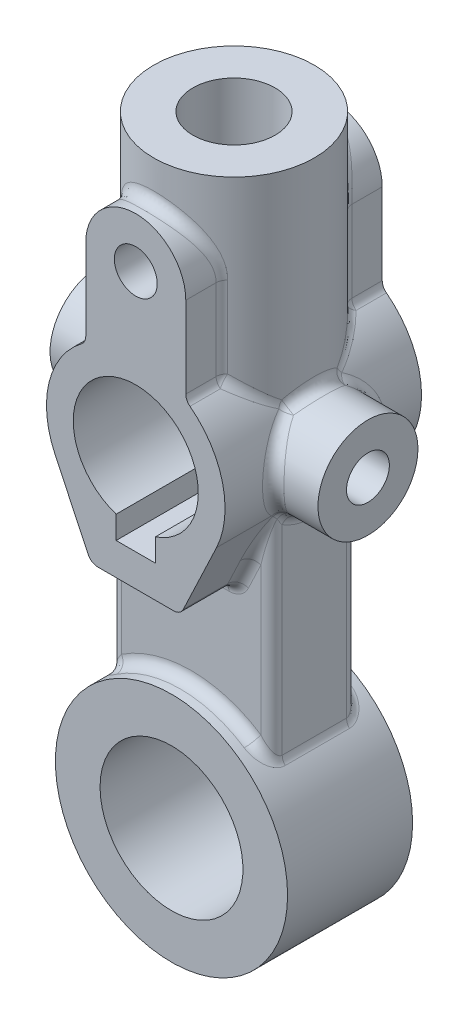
SolidWorks part; units mm, degrees
ref_plane "Front Plane" through (0, 0, 0) normal (0, 0, 1) x (1, 0, 0)
ref_plane "Top Plane" through (0, 0, 0) normal (0, 1, 0) x (1, 0, 0)
ref_plane "Right Plane" through (0, 0, 0) normal (1, 0, 0) x (0, 0, -1)
sketch "Sketch1" plane through (0, 0, 0) normal (0, 0, 1) x (1, 0, 0)
  line L0 (-12.5, -32) -> (-22.5914, -10.7065)
  line L1 (12.5, -32) -> (-12.5, -32)
  line L2 (22.5914, -10.7065) -> (12.5, -32)
  line L3 (0, 0) -> (0, 45) construction
  line L4 (14, 20.7123) -> (14, 45)
  line L5 (-14, 45) -> (-14, 20.7123)
  arc A0 (22.5914, -10.7065) -> (14, 20.7123) centre (0, 0) ccw
  arc A1 (14, 45) -> (-14, 45) centre (0, 45) ccw
  arc A2 (-14, 20.7123) -> (-22.5914, -10.7065) centre (0, 0) ccw
  dimension "D1" = 14
  dimension "D3" = 25
  dimension "D5" = 45
  dimension "D2" = 25
  dimension "D4" = 32
extrude "Boss-Extrude1" add sketch "Sketch1" along normal mid plane 55
sketch "Sketch2" plane through (0, 0, 0) normal (0, 1, 0) x (1, 0, 0)
  circle A0 centre (0, 0) radius 22.5
  dimension "D1" = 45
extrude "Boss-Extrude2" add sketch "Sketch2" along normal blind 70
sketch "Sketch3" plane through (0, 0, 0) normal (0, 1, 0) x (1, 0, 0)
  line L1 (-22.5, 12) -> (22.5, 12)
  line L2 (-22.5, 12) -> (-22.5, -12)
  line L3 (-22.5, -12) -> (22.5, -12)
  line L4 (22.5, 12) -> (22.5, -12)
  line L5 (-22.5, 12) -> (22.5, -12) construction
  line L6 (-22.5, -12) -> (22.5, 12) construction
  arc A0 (14, -17.6139) -> (14, 17.6139) centre (0, 0) ccw construction
  point P0 (0, 0)
  dimension "D1" = 24
extrude "Boss-Extrude3" add sketch "Sketch3" against normal blind 95
sketch "Sketch4" plane through (0, 0, 0) normal (0, 0, 1) x (1, 0, 0)
  line L0 (-22.5, -95) -> (22.5, -95) construction
  circle A0 centre (0, -95) radius 32.5
  dimension "D1" = 65
extrude "Boss-Extrude4" add sketch "Sketch4" along normal mid plane 35
sketch "Sketch5" plane through (0, 0, 0) normal (1, 0, 0) x (0, 0, -1)
  circle A0 centre (0, 0) radius 14
  dimension "D1" = 28
extrude "Boss-Extrude5" add sketch "Sketch5" along normal mid plane 75
sketch "Sketch6" plane through (0, 0, 27.5) normal (0, 0, 1) x (1, 0, 0)
  line L0 (0, 0) -> (0, -23) construction
  line L1 (-5.5, -23) -> (5.5, -23)
  line L2 (5.5, -23) -> (5.5, -16.6132)
  line L3 (-5.5, -23) -> (-5.5, -16.6132)
  arc A0 (5.5, -16.6132) -> (-5.5, -16.6132) centre (0, 0) ccw
  dimension "D3" = 35
  dimension "D2" = 23
  dimension "D1" = 11
extrude "Cut-Extrude1" cut sketch "Sketch6" against normal through all
sketch "Sketch7" plane through (0, 70, 0) normal (0, 1, 0) x (1, 0, 0)
  circle A0 centre (0, 0) radius 11.5
  dimension "D1" = 23
extrude "Cut-Extrude2" cut sketch "Sketch7" against normal up to next
hole_wizard "Ø12.0 (12) Diameter Hole1" positions "Sketch9" profile "Sketch8" hole size "Ø12.0" standard "ANSI Metric"
sketch "Sketch9" plane through (0, 0, 27.5) normal (0, 0, 1) x (1, 0, 0)
  point P0 (0, 45)
sketch "Sketch8" plane through (0, 45, 27.5) normal (1, 0, 0) x (0, -1, 0)
  line L0 (0, 0) -> (0, 55)
  line L1 (0, 55) -> (6, 55)
  line L2 (6, 55) -> (6, 0)
  line L5 (6, 0) -> (0, 0)
  line L11 (0, -6.35) -> (0, 107.95) construction
  dimension "Thru Hole Dia." = 12
  dimension "Thru Hole Depth" = 55
hole_wizard "Ø12.0 (12) Diameter Hole2" positions "Sketch11" profile "Sketch10" hole size "Ø12.0" standard "ANSI Metric"
sketch "Sketch11" plane through (-37.5, 0, 0) normal (-1, 0, 0) x (0, 0, 1)
  point P0 (0, 0)
sketch "Sketch10" plane through (-37.5, 0, 0) normal (0, 1, 0) x (0, 0, 1)
  line L0 (0, 0) -> (0, 75)
  line L1 (0, 75) -> (6, 75)
  line L2 (6, 75) -> (6, 0)
  line L5 (6, 0) -> (0, 0)
  line L11 (0, -6.35) -> (0, 107.95) construction
  dimension "Thru Hole Dia." = 12
  dimension "Thru Hole Depth" = 75
sketch "Sketch12" plane through (0, 0, -17.5) normal (0, 0, -1) x (-1, 0, 0)
  circle A0 centre (0, -95) radius 20
  dimension "D1" = 40
extrude "Cut-Extrude3" cut sketch "Sketch12" against normal through all
fillet "Fillet1" radius 3 4 edges at (-22.5, -41.2236, -12) (-22.5, -41.2236, 12) (22.5, -41.2236, -12) (22.5, -41.2236, 12)
fillet "Fillet2" radius 3 16 edges at (-21.741, -70.8426, 10.9945) (-22.5, -71.5479, 0) (-22.0944, -71.1654, -10.5064) (0, -62.5, -12) (21.741, -70.8426, -10.9945) (22.5, -71.5479, 0) (22.0944, -71.1654, 10.5064) (-24.9996, -0.1361, -13.9993) (-24.9996, -0.1361, -13.9993) (-22.5, -14, 0) (-22.496, 13.9935, -0.425) (22.4928, 13.9884, -0.5692) (24.9996, 0.1361, -13.9993) (24.9996, 0.1361, -13.9993) (22.5, -14, 0) (0, -62.5, 12)
fillet "Fillet3" radius 3 8 edges at (14, 20.7123, 22.557) (-14, 20.7123, 22.557) (14, 20.7123, -22.557) (-14, 20.7123, -22.557) (-12.5, -32, -19.75) (12.5, -32, -19.75) (12.5, -32, 19.75) (-12.5, -32, 19.75)
fillet "Fillet4" radius 3 36 edges at (-23.35, -10.737, 9.6485) (-16.4064, -23.7572, 12) (-16.4064, -23.7572, -12) (-23.35, -10.737, -9.6485) (-22.5994, 12.2121, 7.3945) (22.6028, 12.2108, 7.3938) (14.4347, 20.6932, 17.2595) (14, 33.6243, 17.6139) (0.5692, 58.9884, -22.4928) (0.5692, 31.0116, 22.4928) (-14, 33.6243, 17.6139) (-14.156, 21.2938, 17.4888) (22.6054, 12.2098, -7.3932) (14.156, 21.2938, -17.4888) (14, 33.6243, -17.6139) (-14, 33.6243, -17.6139) (-14.4347, 20.6932, -17.2595) (-22.6063, 12.2095, -7.393) (-20.9175, -14.2385, 11.644) (-20.9175, -14.2385, -11.644) (23.35, -10.737, 9.6485) (20.9175, -14.2385, 11.644) (16.4064, -23.7572, 12) (12.2059, -31.5352, 12) (0, -32, 12) (-12.2059, -31.5352, 12) (23.35, -10.737, -9.6485) (20.9175, -14.2385, -11.644) (16.4064, -23.7572, -12) (12.2059, -31.5352, -12) (0, -32, -12) (-12.2059, -31.5352, -12)
